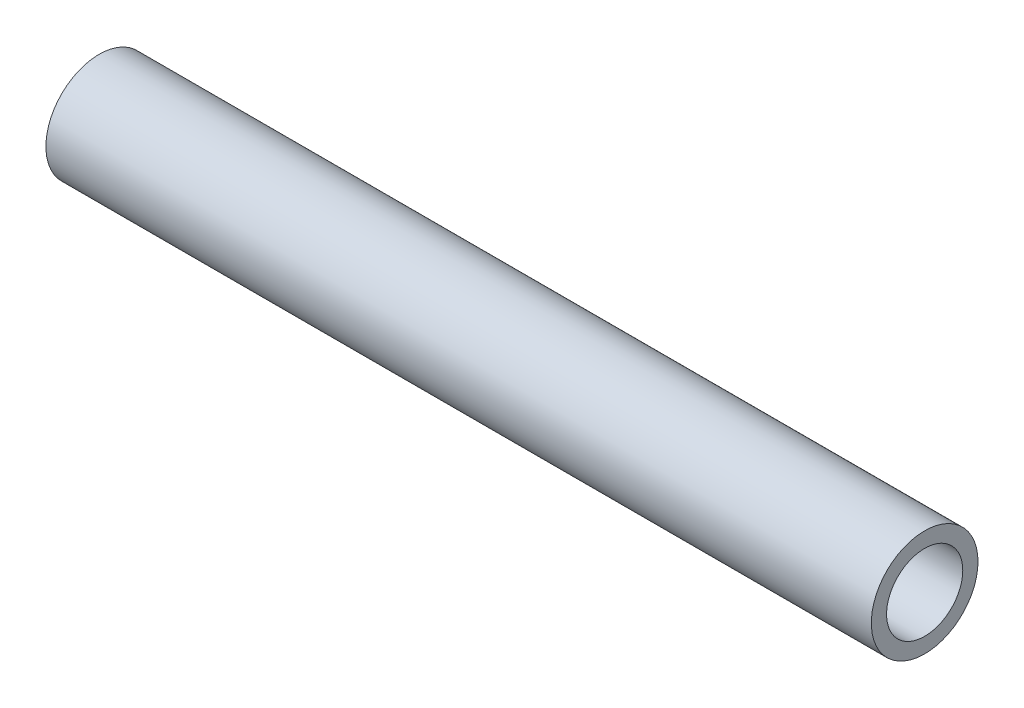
SolidWorks part; units mm, degrees
ref_plane "Front" through (0, 0, 0) normal (0, 0, 1) x (1, 0, 0)
ref_plane "Top" through (0, 0, 0) normal (0, 1, 0) x (1, 0, 0)
ref_plane "Right" through (0, 0, 0) normal (1, 0, 0) x (0, 0, -1)
sketch "Sketch1" plane through (0, 0, 0) normal (0, 0, 1) x (1, 0, 0)
  line L0 (0, 0) -> (165.1, 0)
  line L1 (9.9848, 0) -> (-9.9848, 0) construction
  dimension "D1" = 165.1
other "Structural Member1"
ref_plane "Plane1" through (0, 0, 0) normal (1, 0, 0) x (0, 0, -1)
sketch "Sketch11" plane through (0, 0, 0) normal (1, 0, 0) x (0, 0, -1)
  circle A0 centre (0, 0) radius 7.62
  circle A1 centre (0, 0) radius 10.668
  point P3 (0, 0)
  dimension "D1" = 21.336
  dimension "D2" = 15.24
